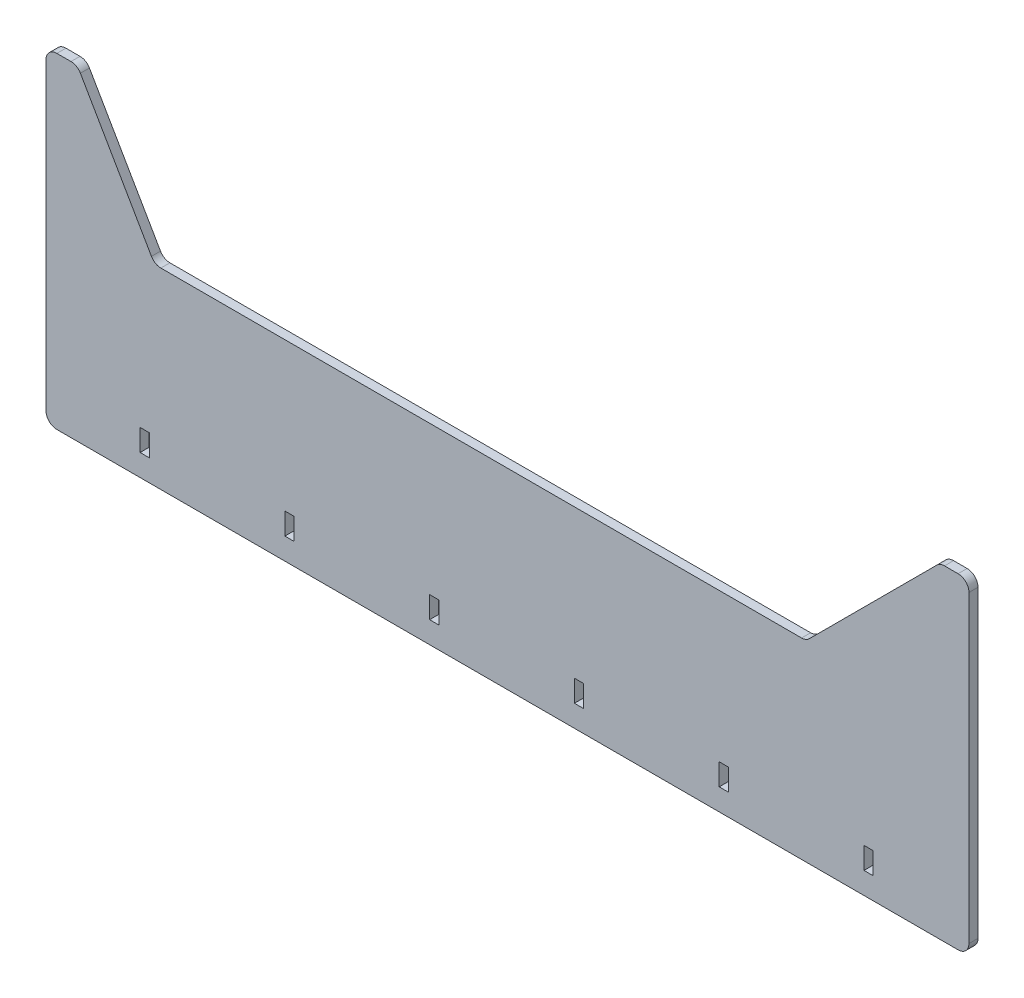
SolidWorks part; units mm, degrees
ref_plane "Front" through (0, 0, 0) normal (0, 0, 1) x (1, 0, 0)
ref_plane "Top" through (0, 0, 0) normal (0, 1, 0) x (1, 0, 0)
ref_plane "Right" through (0, 0, 0) normal (1, 0, 0) x (0, 0, -1)
sketch "草图1" plane through (0, 0, 0) normal (0, 0, 1) x (1, 0, 0)
  line L0 (-76.0165, 7.8352) -> (103.9835, 7.8352)
  line L1 (-106.0165, 44.8352) -> (-97.3784, 44.8352)
  line L2 (-106.0165, 44.8352) -> (-106.0165, -45.1648)
  line L3 (-106.0165, -45.1648) -> (148.9835, -45.1648)
  line L4 (148.9835, 44.8352) -> (148.9835, -45.1648)
  line L5 (103.9835, 7.8352) -> (140.9835, 44.8352)
  line L6 (-76.0165, 7.8352) -> (-97.3784, 44.8352)
  line L7 (140.9835, 44.8352) -> (148.9835, 44.8352)
  line L8 (-40.0165, -33.1648) -> (-37.4865, -33.1648)
  line L9 (-80.0165, -33.1648) -> (-77.4865, -33.1648)
  line L10 (-80.0165, -33.1648) -> (-80.0165, -39.1648)
  line L11 (-80.0165, -39.1648) -> (-77.4865, -39.1648)
  line L12 (-77.4865, -33.1648) -> (-77.4865, -39.1648) construction
  line L13 (-40.0165, -33.1648) -> (-40.0165, -39.1648)
  line L14 (-40.0165, -39.1648) -> (-37.4865, -39.1648)
  line L15 (-37.4865, -33.1648) -> (-37.4865, -39.1648) construction
  line L16 (-0.0165, -33.1648) -> (2.5135, -33.1648)
  line L17 (-0.0165, -33.1648) -> (-0.0165, -39.1648)
  line L18 (-0.0165, -39.1648) -> (2.5135, -39.1648)
  line L19 (2.5135, -33.1648) -> (2.5135, -39.1648) construction
  line L20 (39.9835, -33.1648) -> (42.5135, -33.1648)
  line L21 (39.9835, -33.1648) -> (39.9835, -39.1648)
  line L22 (39.9835, -39.1648) -> (42.5135, -39.1648)
  line L23 (42.5135, -33.1648) -> (42.5135, -39.1648) construction
  line L24 (79.9835, -33.1648) -> (82.5135, -33.1648)
  line L25 (79.9835, -33.1648) -> (79.9835, -39.1648)
  line L26 (79.9835, -39.1648) -> (82.5135, -39.1648)
  line L27 (82.5135, -33.1648) -> (82.5135, -39.1648) construction
  line L28 (119.9835, -33.1648) -> (122.5135, -33.1648)
  line L29 (119.9835, -33.1648) -> (119.9835, -39.1648)
  line L30 (119.9835, -39.1648) -> (122.5135, -39.1648)
  line L31 (122.5135, -33.1648) -> (122.5135, -39.1648) construction
  line L32 (-80.0165, -33.1648) -> (-40.0165, -33.1648) construction
  line L33 (-77.4865, -33.1648) -> (-77.4865, -39.1648)
  line L34 (-37.4865, -33.1648) -> (-37.4865, -39.1648)
  line L35 (2.5135, -33.1648) -> (2.5135, -39.1648)
  line L36 (42.5135, -33.1648) -> (42.5135, -39.1648)
  line L37 (82.5135, -33.1648) -> (82.5135, -39.1648)
  line L38 (122.5135, -33.1648) -> (122.5135, -39.1648)
  point P6 (103.9835, 7.8352)
  point P9 (-76.0165, 7.8352)
  dimension "D1" = 255
  dimension "D2" = 90
  dimension "D3" = 53
  dimension "D4" = 2.53
  dimension "D5" = 45
  dimension "D6" = 6
  dimension "D7" = 60
  dimension "D8" = 6
  dimension "D10" = 40
  dimension "D11" = 26
  dimension "D9" = 6
extrude "凸台-拉伸4" add sketch "草图1" along normal blind 2.5
fillet "圆角1" radius 3 8 edges at (-106.0165, -45.1648, 1.25) (148.9835, -45.1648, 1.25) (148.9835, 44.8352, 1.25) (140.9835, 44.8352, 1.25) (103.9835, 7.8352, 1.25) (-76.0165, 7.8352, 1.25) (-97.3784, 44.8352, 1.25) (-106.0165, 44.8352, 1.25)
